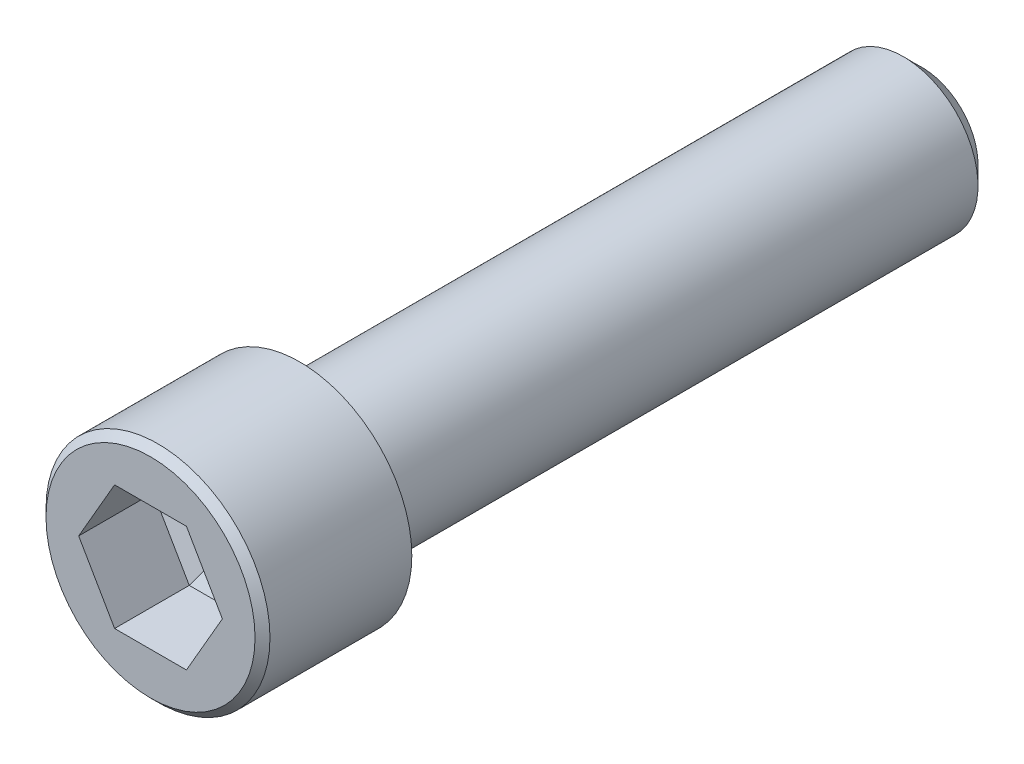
SolidWorks part; units mm, degrees
ref_plane "Plan de face" through (0, 0, 0) normal (0, 0, 1) x (1, 0, 0)
ref_plane "Plan de dessus" through (0, 0, 0) normal (0, 1, 0) x (1, 0, 0)
ref_plane "Plan de droite" through (0, 0, 0) normal (1, 0, 0) x (0, 0, -1)
imported_body "Importée1"
sketch "Esquisse1" plane through (0, 0, -22) normal (0, 0, -1) x (-1, 0, 0)
  circle A0 centre (176.5, -7.85) radius 4.5
  circle A1 centre (176.5, -7.85) radius 5 construction
  circle A2 centre (176.5, -7.85) radius 5
  dimension "D1" = 9
extrude "Extrusion1" cut sketch "Esquisse1" against normal through all
